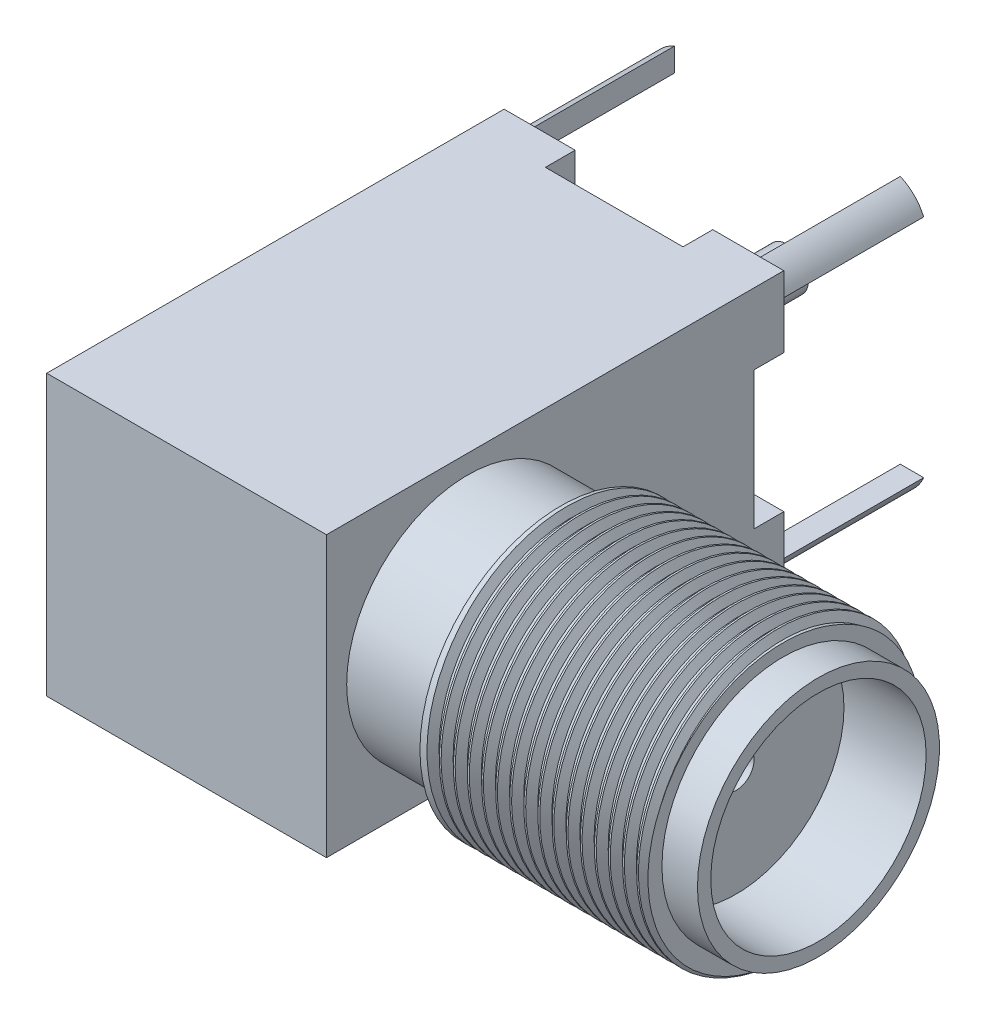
SolidWorks part; units mm, degrees
ref_plane "Front Plane" through (0, 0, 0) normal (0, 0, 1) x (1, 0, 0)
ref_plane "Top Plane" through (0, 0, 0) normal (0, 1, 0) x (1, 0, 0)
ref_plane "Right Plane" through (0, 0, 0) normal (1, 0, 0) x (0, 0, -1)
imported_body "Imported1"
sketch "Sketch1" plane through (0, 0, -3.9) normal (0, 0, -1) x (-1, 0, 0)
  circle A0 centre (0, 0) radius 0.475
  circle A1 centre (0, 0) radius 0.495
  dimension "D1" = 0.95
extrude "Cut-Extrude1" cut sketch "Sketch1" against normal up to surface (4.57 mm away)
sketch "Sketch2" plane through (0, 0, 0.67) normal (0, 0, -1) x (-1, 0, 0)
  circle A0 centre (0, 0) radius 2.25
  dimension "D1" = 4.5
extrude "Cut-Extrude2" cut sketch "Sketch2" against normal blind 0.1
sketch "Sketch3" plane through (0, 0, -3.9) normal (0, 0, -1) x (-1, 0, 0)
  line L0 (2.5424, -2.5424) -> (2.5424, -3.15)
  line L1 (2.15, -2.15) -> (3.3209, -3.3209) construction
  line L2 (2.5424, -2.5424) -> (3.15, -2.5424)
  line L3 (3.15, -2.15) -> (3.15, -2.5424)
  line L4 (2.15, -2.15) -> (3.15, -2.15)
  line L5 (2.15, -2.15) -> (2.15, -3.15)
  line L6 (2.15, -3.15) -> (2.5424, -3.15)
  line L7 (2.15, -3.15) -> (3.15, -3.15) construction
  line L8 (0, 3.5956) -> (0, -4.399) construction
  line L9 (-2.5424, -2.5424) -> (-3.15, -2.5424)
  line L10 (-3.15, -2.15) -> (-3.15, -2.5424)
  line L11 (-2.15, -2.15) -> (-3.15, -2.15)
  line L12 (-2.15, -2.15) -> (-2.15, -3.15)
  line L13 (-2.15, -3.15) -> (-2.5424, -3.15)
  line L14 (-2.5424, -2.5424) -> (-2.5424, -3.15)
  line L15 (-3.4282, 0) -> (4.9424, 0) construction
  line L16 (2.5424, 2.5424) -> (3.15, 2.5424)
  line L17 (3.15, 2.15) -> (3.15, 2.5424)
  line L18 (2.15, 2.15) -> (3.15, 2.15)
  line L19 (2.15, 2.15) -> (2.15, 3.15)
  line L20 (2.15, 3.15) -> (2.5424, 3.15)
  line L21 (2.5424, 2.5424) -> (2.5424, 3.15)
  line L22 (-2.5424, 2.5424) -> (-2.5424, 3.15)
  line L23 (-2.15, 3.15) -> (-2.5424, 3.15)
  line L24 (-2.15, 2.15) -> (-2.15, 3.15)
  line L25 (-2.15, 2.15) -> (-3.15, 2.15)
  line L26 (-3.15, 2.15) -> (-3.15, 2.5424)
  line L27 (-2.5424, 2.5424) -> (-3.15, 2.5424)
  dimension "D1" = 0.555
extrude "Cut-Extrude4" cut sketch "Sketch3" against normal up to surface (3.9 mm away)
sketch "Sketch4" plane through (0, 0, -3.9) normal (0, 0, -1) x (-1, 0, 0)
  line L8 (0, 4.1748) -> (0, -5.1544) construction
  line L9 (-4.3235, 0) -> (6.4561, 0) construction
  line L10 (-3.0773, 2.5374) -> (-2.5374, 2.5374)
  line L11 (-2.5374, 2.5374) -> (-2.5374, 3.0773)
  line L12 (-3.0773, 2.5374) -> (-2.5374, 2.5374)
  line L13 (-2.5374, 2.5374) -> (-2.5374, 3.0773)
  line L14 (2.5374, 2.5374) -> (2.5374, 3.0773)
  line L15 (3.0773, 2.5374) -> (2.5374, 2.5374)
  line L16 (3.0773, -2.5374) -> (2.5374, -2.5374)
  line L17 (2.5374, -2.5374) -> (2.5374, -3.0773)
  line L18 (-2.5374, -2.5374) -> (-2.5374, -3.0773)
  line L19 (-3.0773, -2.5374) -> (-2.5374, -2.5374)
  circle A0 centre (0, 0) radius 0.475
  arc A2 (2.5374, 3.0773) -> (3.0773, 2.5374) centre (2.15, 2.15) cw
  arc A3 (-2.5374, 3.0773) -> (-3.0773, 2.5374) centre (-2.15, 2.15) ccw
  arc A4 (-2.5374, 3.0773) -> (-3.0773, 2.5374) centre (-2.15, 2.15) ccw
  arc A5 (2.5374, -3.0773) -> (3.0773, -2.5374) centre (2.15, -2.15) ccw
  arc A6 (-2.5374, -3.0773) -> (-3.0773, -2.5374) centre (-2.15, -2.15) cw
  dimension "D1" = 0.005
extrude "Cut-Extrude5" cut sketch "Sketch4" against normal blind 0.67
